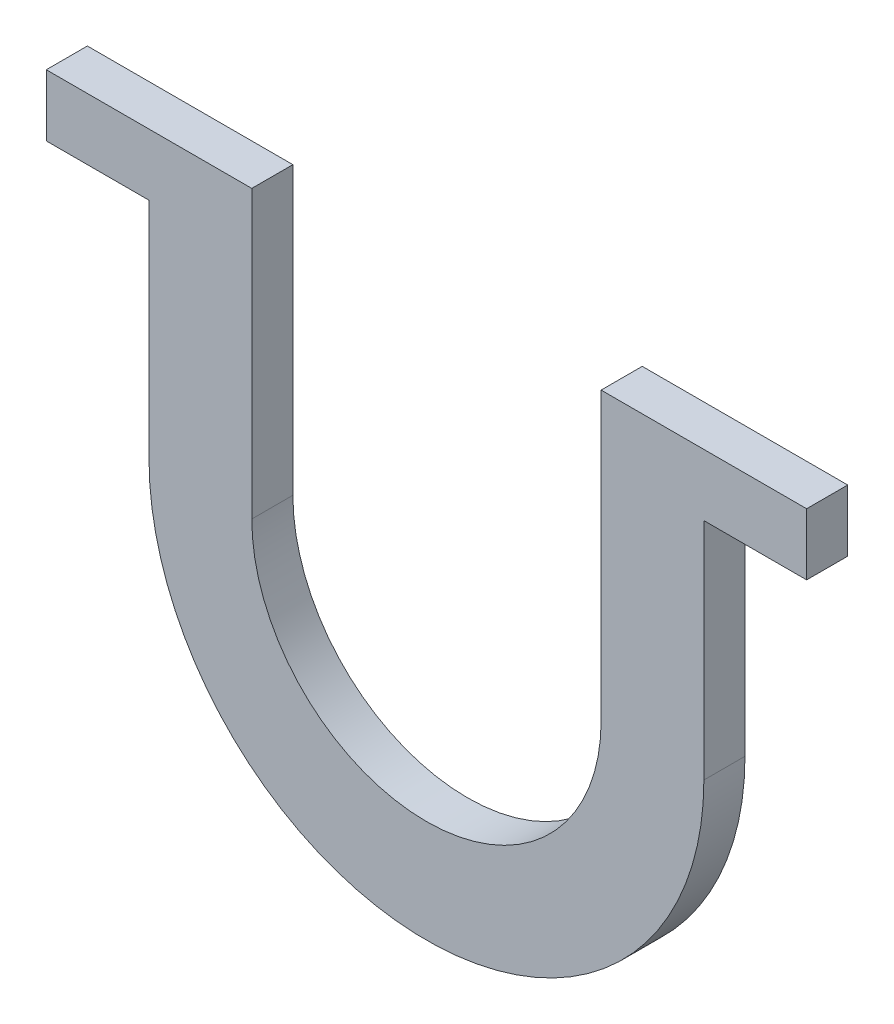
SolidWorks part; units mm, degrees
ref_plane "Front Plane" through (0, 0, 0) normal (0, 0, 1) x (1, 0, 0)
ref_plane "Top Plane" through (0, 0, 0) normal (0, 1, 0) x (1, 0, 0)
ref_plane "Right Plane" through (0, 0, 0) normal (1, 0, 0) x (0, 0, -1)
sketch "Sketch1" plane through (0, 0, 0) normal (0, 0, 1) x (1, 0, 0)
  line L0 (-26.1578, 1.5933) -> (-41.9893, 1.5933) construction
  line L1 (-41.9893, 29.4608) -> (-41.9893, 1.5933)
  line L2 (-31.9893, 29.4608) -> (-41.9893, 29.4608)
  line L3 (2.0107, 29.4608) -> (2.0107, 1.5933)
  line L5 (2.0107, 29.4608) -> (12.0107, 29.4608)
  line L6 (-31.9893, 29.4608) -> (-31.9893, 1.5933)
  line L8 (12.0107, 29.4608) -> (12.0107, 1.5933)
  arc A0 (-41.9893, 1.5933) -> (12.0107, 1.5933) centre (-14.9893, 1.5933) ccw
  arc A2 (-31.9893, 1.5933) -> (2.0107, 1.5933) centre (-14.9893, 1.5933) ccw
  point P1 (0, 0)
  point P9 (0, 0)
  point P11 (0, 0)
  dimension "D3" = 34
extrude "Boss-Extrude1" add sketch "Sketch1" along normal blind 4
sketch "Sketch4" plane through (12.0107, 0, 0) normal (1, 0, 0) x (0, 0, -1)
  line L0 (0, 1.5933) -> (0, 29.4608) construction
  line L1 (-4, 29.4608) -> (0, 29.4608)
  line L2 (-4, 29.4608) -> (-4, 23.4608)
  line L3 (-4, 23.4608) -> (0, 23.4608)
  line L4 (0, 29.4608) -> (0, 23.4608)
  dimension "D1" = 6
extrude "Boss-Extrude4" add sketch "Sketch4" along normal blind 10
sketch "Sketch5" plane through (-41.9893, 0, 0) normal (-1, 0, 0) x (0, 0, 1)
  line L0 (4, 29.4608) -> (0, 29.4608) construction
  line L1 (0, 29.4608) -> (4, 29.4608)
  line L2 (0, 29.4608) -> (0, 23.4608)
  line L3 (0, 23.4608) -> (4, 23.4608)
  line L4 (4, 29.4608) -> (4, 23.4608)
  line L5 (0, 29.4608) -> (0, 1.5933) construction
  line L6 (4, 29.4608) -> (4, 1.5933) construction
  dimension "D1" = 6
extrude "Boss-Extrude5" add sketch "Sketch5" along normal blind 10
equation "\"thickness of material\"= 4mm"
equation "\"Length\"= 120mm"
equation "\"width\"= 60mm"
equation "\"length of strip\"= 60mm"
equation "\"width of strip\"= 10mm"
equation "\"D1@Boss-Extrude1\"=\"thickness of material\""
equation "\"D1\"= \"thickness of material\""
